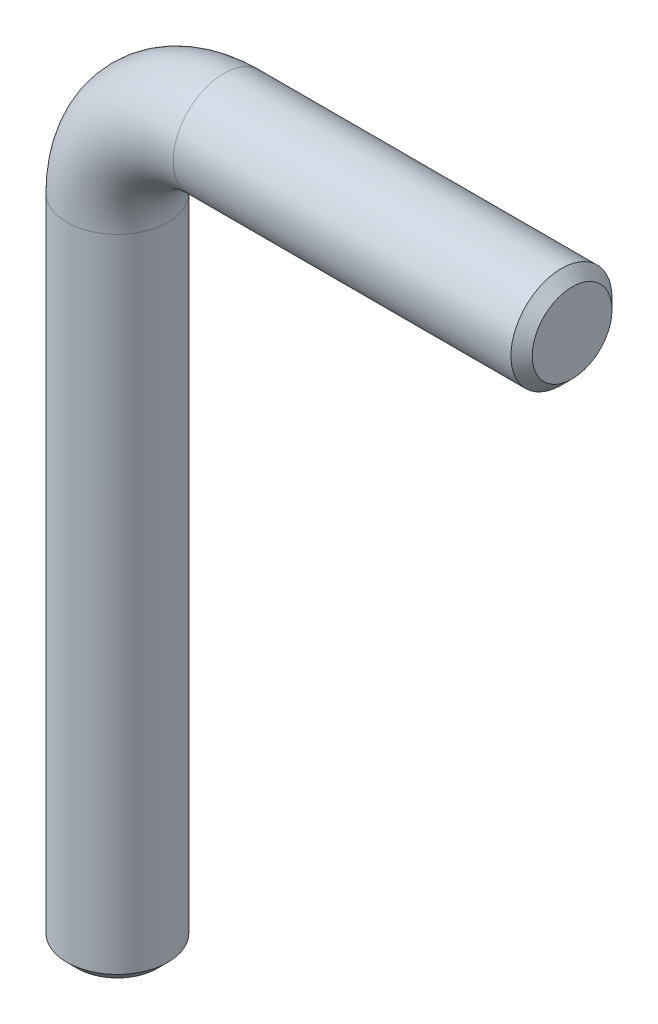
SolidWorks part; units mm, degrees
ref_plane "LAT. ESQUERDO" through (0, 0, 0) normal (0, 0, 1) x (1, 0, 0)
ref_plane "SUPERIOR" through (0, 0, 0) normal (0, 1, 0) x (1, 0, 0)
ref_plane "FRONTAL" through (0, 0, 0) normal (1, 0, 0) x (0, 0, -1)
sketch "Esboço1" plane through (0, 0, 0) normal (0, 0, 1) x (1, 0, 0)
  line L0 (0, 0) -> (0, 61.25)
  line L1 (10, 71.25) -> (42.75, 71.25)
  arc A0 (0, 61.25) -> (10, 71.25) centre (10, 61.25) cw
  dimension "D3" = 10
  dimension "D1" = 71.25
  dimension "D2" = 42.75
sketch "Esboço2" plane through (0, 0, 0) normal (0, 1, 0) x (1, 0, 0)
  circle A0 centre (0, 0) radius 4.75
  dimension "D1" = 9.5
sweep "Varredura1" add profiles "Esboço2" path "Esboço1"
chamfer "Chanfro1" distance 1 angle 45 2 edges at (42.75, 71.25, 4.75) (0, 0, 4.75)
